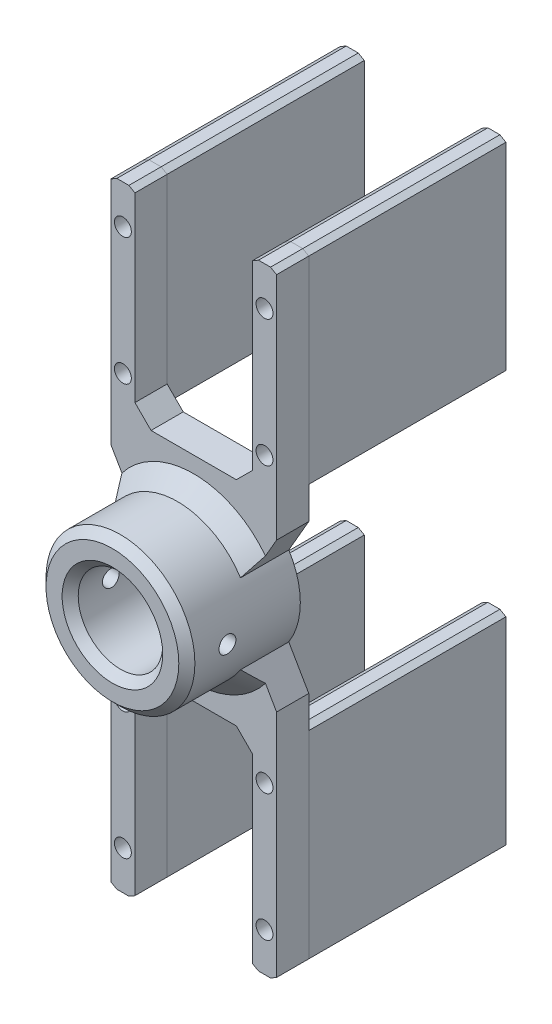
SolidWorks part; units mm, degrees
ref_plane "Top Plane" through (0, 0, 0) normal (0, 0, 1) x (1, 0, 0)
ref_plane "Front Plane" through (0, 0, 0) normal (0, 1, 0) x (1, 0, 0)
ref_plane "Right Plane" through (0, 0, 0) normal (1, 0, 0) x (0, 0, -1)
sketch "Sketch1" plane through (0, 0, 0) normal (0, 0, 1) x (1, 0, 0)
  circle A0 centre (0, 0) radius 10.5
  circle A1 centre (0, 0) radius 18.5
  point P7 (0, 0)
  point P11 (0, 0)
extrude "Boss-Extrude1" add sketch "Sketch1" along normal blind 20.2
sketch "Sketch2" plane through (0, 0, 0) normal (1, 0, 0) x (0, 0, -1)
  line L0 (-20.2, 18.5) -> (-20.2, -18.5) construction
  line L1 (0, -18.5) -> (0, 18.5) construction
  line L2 (-20.2, 18.5) -> (-20.2, -18.5) construction
  line L3 (0, -18.5) -> (0, 18.5) construction
  line L4 (-20.2, 0) -> (0, 0) construction
  circle A0 centre (-10.1, 0) radius 2.1
extrude "Cut-Extrude1" cut sketch "Sketch2" against normal up to surface and the other way up to surface
sketch "Sketch3" plane through (0, 0, 0) normal (0, 0, -1) x (-1, 0, 0)
  line L0 (0, 65.012) -> (0, -65.012) construction
  line L1 (-54.6926, 0) -> (54.6926, 0) construction
  line L2 (-14.6, -75.634) -> (0, -75.634) construction
  line L4 (-20.6, -75.634) -> (-20.6, -18.5)
  line L6 (-14.6, -75.634) -> (-14.6, -26.5)
  line L8 (14.6, -75.634) -> (14.6, -26.5)
  line L10 (20.6, -75.634) -> (20.6, -18.5)
  line L11 (0, -75.634) -> (14.6, -75.634) construction
  line L12 (-20.6, -18.5) -> (-20.6, 18.5) construction
  line L13 (-14.6, -26.5) -> (14.6, -26.5) construction
  line L14 (-20.6, -18.5) -> (-15.6316, -9.8945)
  line L15 (20.6, -18.5) -> (15.6316, -9.8945)
  line L16 (-20.6, -18.5) -> (0, -18.5) construction
  line L17 (-14.6, -26.5) -> (14.6, -26.5)
  line L18 (0, -18.5) -> (20.6, -18.5) construction
  line L19 (-19.1, -76.5) -> (-16.1, -76.5)
  line L20 (19.1, -76.5) -> (16.1, -76.5)
  line L21 (-20.6, -75.634) -> (-19.1, -76.5)
  line L22 (-16.1, -76.5) -> (-14.6, -75.634)
  line L23 (14.6, -75.634) -> (16.1, -76.5)
  line L24 (19.1, -76.5) -> (20.6, -75.634)
  line L25 (14.6, -26.5) -> (20.6, -26.5) construction
  line L26 (-14.6, -26.5) -> (-20.6, -26.5) construction
  line L27 (-17.6, -76.5) -> (-17.6, -26.5) construction
  line L28 (20.6, 18.5) -> (15.6316, 9.8945)
  line L29 (-17.6, 76.5) -> (-17.6, 26.5) construction
  line L30 (-14.6, 26.5) -> (-20.6, 26.5) construction
  line L31 (14.6, 26.5) -> (20.6, 26.5) construction
  line L32 (0, 18.5) -> (20.6, 18.5) construction
  line L33 (-20.6, 18.5) -> (0, 18.5) construction
  line L34 (-14.6, 26.5) -> (14.6, 26.5) construction
  line L35 (0, 75.634) -> (14.6, 75.634) construction
  line L36 (-14.6, 75.634) -> (0, 75.634) construction
  line L37 (19.1, 76.5) -> (20.6, 75.634)
  line L38 (14.6, 75.634) -> (16.1, 76.5)
  line L39 (-16.1, 76.5) -> (-14.6, 75.634)
  line L40 (-20.6, 75.634) -> (-19.1, 76.5)
  line L41 (19.1, 76.5) -> (16.1, 76.5)
  line L42 (-19.1, 76.5) -> (-16.1, 76.5)
  line L43 (-14.6, 26.5) -> (14.6, 26.5)
  line L44 (-20.6, 18.5) -> (-15.6316, 9.8945)
  line L45 (20.6, 75.634) -> (20.6, 18.5)
  line L46 (14.6, 75.634) -> (14.6, 26.5)
  line L47 (-14.6, 75.634) -> (-14.6, 26.5)
  line L48 (-20.6, 75.634) -> (-20.6, 18.5)
  circle A0 centre (0, 0) radius 18.5 construction
  circle A1 centre (0, 0) radius 10.5 construction
  arc A2 (15.6316, -9.8945) -> (15.6316, 9.8945) centre (0, 0) ccw
  circle A3 centre (0, 0) radius 10.5
  arc A4 (-15.6316, 9.8945) -> (-15.6316, -9.8945) centre (0, 0) ccw
  point P6 (0, 0)
  point P10 (0, 0)
  point P26 (0, 0)
  point P30 (-17.6, -26.5)
  point P45 (-20.6, 0)
extrude "Boss-Extrude2" add sketch "Sketch3" along normal blind 8
sketch "Sketch4" plane through (0, 0, -8) normal (0, 0, -1) x (-1, 0, 0)
  line L0 (-20.6, -75.634) -> (-20.6, -26.5)
  line L1 (-20.6, -75.634) -> (-19.1, -76.5) construction
  line L2 (-19.1, -76.5) -> (-16.1, -76.5) construction
  line L3 (-16.1, -76.5) -> (-14.6, -75.634) construction
  line L4 (-14.6, -75.634) -> (-14.6, -26.5) construction
  line L5 (-14.6, -51.067) -> (-28.7649, -51.067) construction
  line L6 (-20.6, -75.634) -> (-19.1, -76.5)
  line L7 (-19.1, -76.5) -> (-16.1, -76.5)
  line L8 (-16.1, -76.5) -> (-14.6, -75.634)
  line L9 (-14.6, -75.634) -> (-14.6, -26.5)
  line L10 (-16.1, -25.634) -> (-14.6, -26.5)
  line L11 (-19.1, -25.634) -> (-16.1, -25.634)
  line L12 (-20.6, -26.5) -> (-19.1, -25.634)
  line L13 (-17.6, -76.5) -> (-17.6, -25.634) construction
  line L14 (-114.7213, 0) -> (114.7213, 0) construction
  line L15 (0, 82.1537) -> (0, -82.1537) construction
  line L16 (-17.6, 76.5) -> (-17.6, 25.634) construction
  line L17 (-14.6, 51.067) -> (-28.7649, 51.067) construction
  line L18 (-20.6, 26.5) -> (-19.1, 25.634)
  line L19 (-19.1, 25.634) -> (-16.1, 25.634)
  line L20 (-16.1, 25.634) -> (-14.6, 26.5)
  line L21 (-14.6, 75.634) -> (-14.6, 26.5)
  line L22 (-16.1, 76.5) -> (-14.6, 75.634)
  line L23 (-19.1, 76.5) -> (-16.1, 76.5)
  line L24 (-20.6, 75.634) -> (-19.1, 76.5)
  line L25 (-20.6, 75.634) -> (-20.6, 26.5)
  line L26 (17.6, -76.5) -> (17.6, -25.634) construction
  line L27 (14.6, -51.067) -> (28.7649, -51.067) construction
  line L28 (20.6, -26.5) -> (19.1, -25.634)
  line L29 (19.1, -25.634) -> (16.1, -25.634)
  line L30 (16.1, -25.634) -> (14.6, -26.5)
  line L31 (14.6, -75.634) -> (14.6, -26.5)
  line L32 (16.1, -76.5) -> (14.6, -75.634)
  line L33 (19.1, -76.5) -> (16.1, -76.5)
  line L34 (20.6, -75.634) -> (19.1, -76.5)
  line L35 (20.6, -75.634) -> (20.6, -26.5)
  line L36 (14.6, 51.067) -> (28.7649, 51.067) construction
  line L37 (17.6, 76.5) -> (17.6, 25.634) construction
  line L38 (20.6, 75.634) -> (20.6, 26.5)
  line L39 (20.6, 75.634) -> (19.1, 76.5)
  line L40 (19.1, 76.5) -> (16.1, 76.5)
  line L41 (16.1, 76.5) -> (14.6, 75.634)
  line L42 (14.6, 75.634) -> (14.6, 26.5)
  line L43 (16.1, 25.634) -> (14.6, 26.5)
  line L44 (19.1, 25.634) -> (16.1, 25.634)
  line L45 (20.6, 26.5) -> (19.1, 25.634)
  circle A0 centre (-17.6, -66.85) radius 1.65
  circle A1 centre (-17.6, -35.284) radius 1.65
  circle A2 centre (-17.6, 35.284) radius 1.65
  circle A3 centre (-17.6, 66.85) radius 1.65
  circle A4 centre (17.6, -35.284) radius 1.65
  circle A5 centre (17.6, -66.85) radius 1.65
  circle A6 centre (17.6, 66.85) radius 1.65
  circle A7 centre (17.6, 35.284) radius 1.65
  point P22 (0, 0)
  point P26 (0, 0)
extrude "Boss-Extrude3" add sketch "Sketch4" along normal blind 25 separate body
sketch "Sketch5" plane through (0, 0, -33) normal (0, 0, -1) x (-1, 0, 0)
  line L0 (-20.6, 75.634) -> (-20.6, 26.5) construction
  line L1 (-20.6, 26.5) -> (-19.1, 25.634) construction
  line L2 (-19.1, 25.634) -> (-16.1, 25.634) construction
  line L3 (-16.1, 25.634) -> (-14.6, 26.5) construction
  line L4 (-14.6, 26.5) -> (-14.6, 75.634) construction
  line L5 (-14.6, 75.634) -> (-16.1, 76.5) construction
  line L6 (-16.1, 76.5) -> (-19.1, 76.5) construction
  line L7 (-19.1, 76.5) -> (-20.6, 75.634) construction
  line L8 (20.6, 75.634) -> (19.1, 76.5) construction
  line L9 (19.1, 76.5) -> (16.1, 76.5) construction
  line L10 (16.1, 76.5) -> (14.6, 75.634) construction
  line L11 (14.6, 75.634) -> (14.6, 26.5) construction
  line L12 (14.6, 26.5) -> (16.1, 25.634) construction
  line L13 (16.1, 25.634) -> (19.1, 25.634) construction
  line L14 (19.1, 25.634) -> (20.6, 26.5) construction
  line L15 (20.6, 26.5) -> (20.6, 75.634) construction
  line L16 (20.6, -75.634) -> (20.6, -26.5) construction
  line L17 (20.6, -26.5) -> (19.1, -25.634) construction
  line L18 (19.1, -25.634) -> (16.1, -25.634) construction
  line L19 (16.1, -25.634) -> (14.6, -26.5) construction
  line L20 (14.6, -26.5) -> (14.6, -75.634) construction
  line L21 (14.6, -75.634) -> (16.1, -76.5) construction
  line L22 (16.1, -76.5) -> (19.1, -76.5) construction
  line L23 (19.1, -76.5) -> (20.6, -75.634) construction
  line L24 (-20.6, -75.634) -> (-19.1, -76.5) construction
  line L25 (-19.1, -76.5) -> (-16.1, -76.5) construction
  line L26 (-16.1, -76.5) -> (-14.6, -75.634) construction
  line L27 (-14.6, -75.634) -> (-14.6, -26.5) construction
  line L28 (-14.6, -26.5) -> (-16.1, -25.634) construction
  line L29 (-16.1, -25.634) -> (-19.1, -25.634) construction
  line L30 (-19.1, -25.634) -> (-20.6, -26.5) construction
  line L31 (-20.6, -26.5) -> (-20.6, -75.634) construction
  line L32 (-20.6, 75.634) -> (-20.6, 26.5)
  line L33 (-20.6, 26.5) -> (-19.1, 25.634)
  line L34 (-19.1, 25.634) -> (-16.1, 25.634)
  line L35 (-16.1, 25.634) -> (-14.6, 26.5)
  line L36 (-14.6, 26.5) -> (-14.6, 75.634)
  line L37 (-14.6, 75.634) -> (-16.1, 76.5)
  line L38 (-16.1, 76.5) -> (-19.1, 76.5)
  line L39 (-19.1, 76.5) -> (-20.6, 75.634)
  line L40 (20.6, 75.634) -> (19.1, 76.5)
  line L41 (19.1, 76.5) -> (16.1, 76.5)
  line L42 (16.1, 76.5) -> (14.6, 75.634)
  line L43 (14.6, 75.634) -> (14.6, 26.5)
  line L44 (14.6, 26.5) -> (16.1, 25.634)
  line L45 (16.1, 25.634) -> (19.1, 25.634)
  line L46 (19.1, 25.634) -> (20.6, 26.5)
  line L47 (20.6, 26.5) -> (20.6, 75.634)
  line L48 (20.6, -75.634) -> (20.6, -26.5)
  line L49 (20.6, -26.5) -> (19.1, -25.634)
  line L50 (19.1, -25.634) -> (16.1, -25.634)
  line L51 (16.1, -25.634) -> (14.6, -26.5)
  line L52 (14.6, -26.5) -> (14.6, -75.634)
  line L53 (14.6, -75.634) -> (16.1, -76.5)
  line L54 (16.1, -76.5) -> (19.1, -76.5)
  line L55 (19.1, -76.5) -> (20.6, -75.634)
  line L56 (-20.6, -75.634) -> (-19.1, -76.5)
  line L57 (-19.1, -76.5) -> (-16.1, -76.5)
  line L58 (-16.1, -76.5) -> (-14.6, -75.634)
  line L59 (-14.6, -75.634) -> (-14.6, -26.5)
  line L60 (-14.6, -26.5) -> (-16.1, -25.634)
  line L61 (-16.1, -25.634) -> (-19.1, -25.634)
  line L62 (-19.1, -25.634) -> (-20.6, -26.5)
  line L63 (-20.6, -26.5) -> (-20.6, -75.634)
extrude "Boss-Extrude4" add sketch "Sketch5" along normal blind 24
sketch "Sketch6" plane through (0, 0, 0) normal (0, 0, 1) x (1, 0, 0)
  circle A0 centre (-17.6, -35.284) radius 1.65 construction
  circle A1 centre (-17.6, -66.85) radius 1.65 construction
  circle A2 centre (17.6, -66.85) radius 1.65 construction
  circle A3 centre (17.6, -35.284) radius 1.65 construction
  circle A4 centre (17.6, 35.284) radius 1.65 construction
  circle A5 centre (-17.6, 35.284) radius 1.65 construction
  circle A6 centre (-17.6, 66.85) radius 1.65 construction
  circle A7 centre (17.6, 66.85) radius 1.65 construction
  circle A8 centre (-17.6, -35.284) radius 1.65 construction
  circle A9 centre (-17.6, -66.85) radius 1.65 construction
  circle A10 centre (17.6, -66.85) radius 1.65 construction
  circle A11 centre (17.6, -35.284) radius 1.65 construction
  circle A12 centre (17.6, 35.284) radius 1.65 construction
  circle A13 centre (-17.6, 35.284) radius 1.65 construction
  circle A14 centre (-17.6, 66.85) radius 1.65 construction
  circle A15 centre (17.6, 66.85) radius 1.65 construction
  circle A16 centre (17.6, 66.85) radius 2.1
  circle A17 centre (17.6, 35.284) radius 2.1
  circle A18 centre (-17.6, 35.284) radius 2.1
  circle A19 centre (-17.6, 66.85) radius 2.1
  circle A20 centre (-17.6, -35.284) radius 2.1
  circle A21 centre (17.6, -35.284) radius 2.1
  circle A22 centre (17.6, -66.85) radius 2.1
  circle A23 centre (-17.6, -66.85) radius 2.1
extrude "Cut-Extrude2" cut sketch "Sketch6" against normal up to surface (8 mm away)
chamfer "Chamfer1" distance 4 angle 45 4 edges at (14.6, 26.5, -4) (-14.6, 26.5, -4) (14.6, -26.5, -4) (-14.6, -26.5, -4)
chamfer "Chamfer2" distance 4 angle 45 2 edges at (0, -18.5, 0) (0, 18.5, 0)
chamfer "Chamfer3" distance 2 angle 45 3 edges at (-10.5, 0, -8) (10.5, 0, 20.2) (18.5, 0, 20.2)
equation "\"bore-id\"= 15"
equation "\"chuck-distance\"= 57"
equation "\"jaw-width\"= 25.2"
equation "\"bolt-diameter\"= 4.2"
equation "\"wall-thickness\"= 8"
equation "\"dog-thickness\"= 6"
equation "\"bore-clearance\"= 6"
equation "\"dog-clearance\"= 2"
equation "\"D1@Sketch1\"=\"bore-id\"+\"bore-clearance\""
equation "\"D2@Sketch1\"= \"wall-thickness\""
equation "\"D1@Boss-Extrude1\"= \"bolt-diameter\" + \"wall-thickness\" * 2"
equation "\"D1@Sketch2\"=\"bolt-diameter\""
equation "\"D1@Sketch3\"= ( \"jaw-width\" / 2 + \"dog-clearance\" )"
equation "\"D2@Sketch3\"=(\"bore-id\"+\"bore-clearance\")/2 + \"wall-thickness\""
equation "\"D5@Sketch3\"=\"dog-thickness\""
equation "\"D6@Sketch3\"=\"wall-thickness\""
equation "\"D1@Boss-Extrude2\"= \"wall-thickness\""
equation "\"dog-screws\"= 3.3"
equation "\"D1@Sketch4\"=\"dog-screws\""
equation "\"D2@Sketch4\"=\"wall-thickness\"+\"dog-screws\"/2"
equation "\"dog-screw-depth\"= 25"
equation "\"D1@Boss-Extrude3\"= \"dog-screw-depth\""
equation "\"D1@Boss-Extrude4\"= \"chuck-distance\" - \"dog-screw-depth\" - \"wall-thickness\""
equation "\"dog-screws-clearance\"= 4.2"
equation "\"D1@Sketch6\"=\"dog-screws-clearance\""
